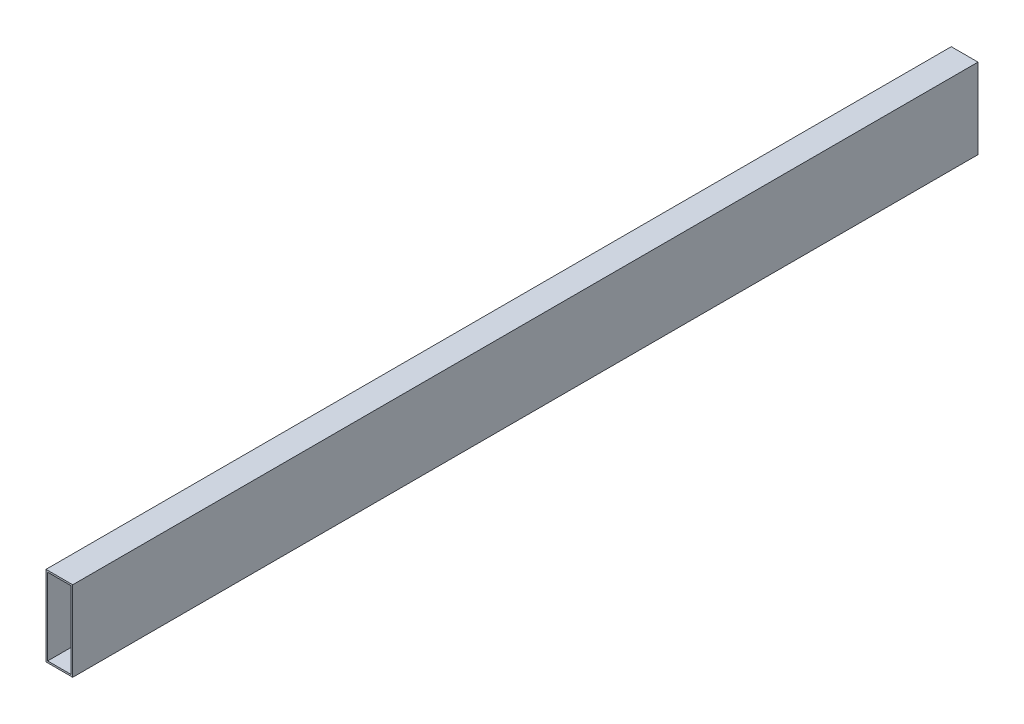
SolidWorks part; units mm, degrees
ref_plane "Front Plane" through (0, 0, 0) normal (0, 0, 1) x (1, 0, 0)
ref_plane "Top Plane" through (0, 0, 0) normal (0, 1, 0) x (1, 0, 0)
ref_plane "Right Plane" through (0, 0, 0) normal (1, 0, 0) x (0, 0, -1)
ref_plane "Plane1" through (0, 0, 1720.85) normal (0, 0, 1) x (1, 0, 0)
sketch "Sketch1" plane through (0, 0, 1720.85) normal (0, 0, 1) x (1, 0, 0)
  line L0 (0, 152.4) -> (0, 0)
  line L1 (0, 0) -> (50.8, 0)
  line L2 (50.8, 0) -> (50.8, 152.4)
  line L3 (50.8, 152.4) -> (0, 152.4)
  line L4 (3.175, 3.175) -> (3.175, 149.225)
  line L5 (3.175, 149.225) -> (47.625, 149.225)
  line L6 (47.625, 149.225) -> (47.625, 3.175)
  line L7 (47.625, 3.175) -> (3.175, 3.175)
extrude "Boss-Extrude1" add sketch "Sketch1" against normal blind 1720.85
